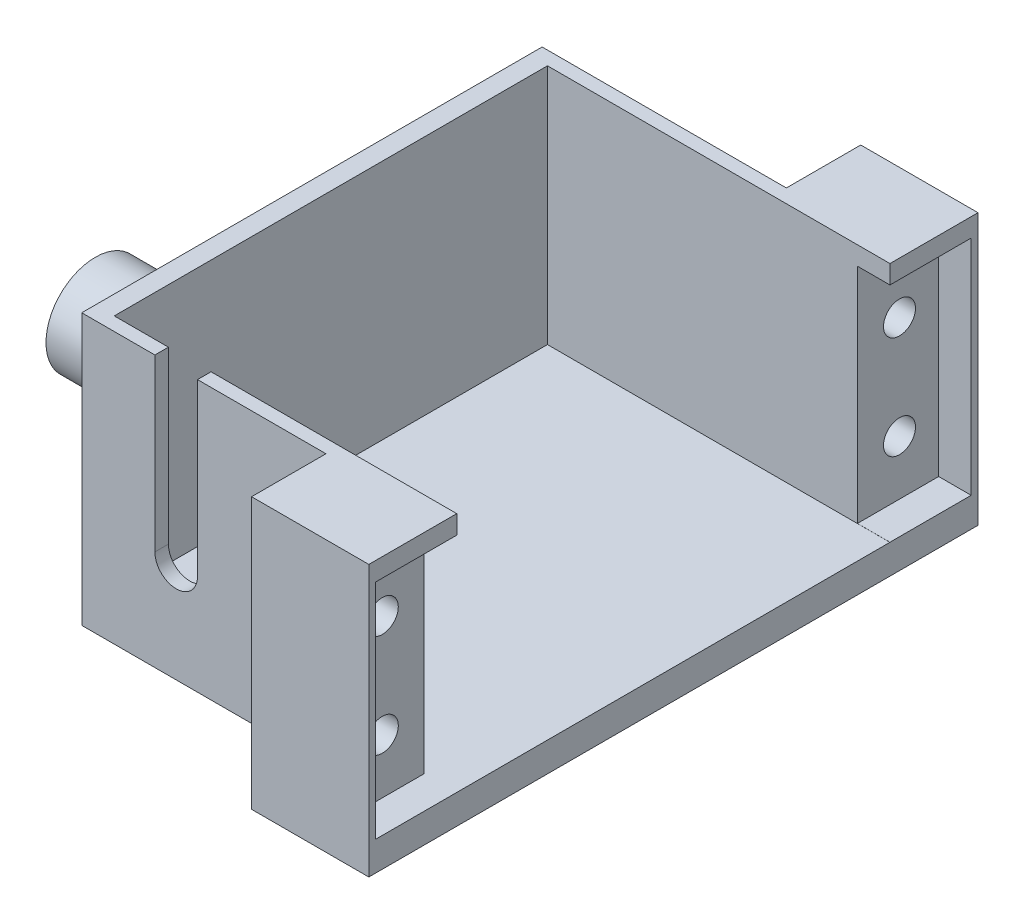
SolidWorks part; units mm, degrees
ref_plane "Front Plane" through (0, 0, 0) normal (0, 0, 1) x (1, 0, 0)
ref_plane "Top Plane" through (0, 0, 0) normal (0, 1, 0) x (1, 0, 0)
ref_plane "Right Plane" through (0, 0, 0) normal (1, 0, 0) x (0, 0, -1)
sketch "Sketch1" plane through (0, 0, 0) normal (0, 1, 0) x (1, 0, 0)
  line L1 (-16.955, -28.575) -> (16.955, -28.575)
  line L2 (-16.955, -28.575) -> (-16.955, 28.575)
  line L3 (-16.955, 28.575) -> (16.955, 28.575)
  line L4 (16.955, -28.575) -> (16.955, 28.575)
  line L5 (-16.955, -28.575) -> (16.955, 28.575) construction
  line L6 (-16.955, 28.575) -> (16.955, -28.575) construction
  point P0 (0, 0)
  dimension "D1" = 57.15
  dimension "D2" = 33.91
extrude "Boss-Extrude1" add sketch "Sketch1" along normal blind 25.4
sketch "Sketch2" plane through (16.955, 0, 0) normal (1, 0, 0) x (0, 0, -1)
  line L0 (0, 0) -> (0, 25.4) construction
  line L1 (-28.575, 25.4) -> (28.575, 25.4) construction
  line L2 (-28.575, 12.7) -> (28.575, 12.7) construction
  line L3 (-28.575, 25.4) -> (-28.575, 0) construction
  line L4 (28.575, 25.4) -> (28.575, 0) construction
  line L5 (-24.26, 17.525) -> (-24.26, 7.875) construction
  circle A0 centre (-24.26, 17.525) radius 1.5
  circle A1 centre (-24.26, 7.875) radius 1.5
  circle A2 centre (24.26, 7.875) radius 1.5
  circle A3 centre (24.26, 17.525) radius 1.5
  point P15 (-24.26, 12.7)
  dimension "D1" = 3
  dimension "D2" = 9.65
  dimension "D3" = 24.26
extrude "Cut-Extrude1" cut sketch "Sketch2" against normal up to next
sketch "Sketch3" plane through (16.955, 0, 0) normal (1, 0, 0) x (0, 0, -1)
  line L0 (-28.575, 25.4) -> (28.575, 25.4) construction
  line L1 (-20.325, 25.4) -> (20.315, 25.4)
  line L2 (-20.325, 25.4) -> (-20.325, 2.75)
  line L3 (-20.325, 2.75) -> (20.315, 2.75)
  line L4 (20.315, 25.4) -> (20.315, 2.75)
  line L5 (-28.575, 0) -> (28.575, 0) construction
  line L6 (28.575, 25.4) -> (28.575, 0) construction
  dimension "D1" = 2.75
  dimension "D2" = 40.64
  dimension "D3" = 8.26
extrude "Cut-Extrude2" cut sketch "Sketch3" against normal blind 32.13
sketch "Sketch4" plane through (16.955, 0, 0) normal (1, 0, 0) x (0, 0, -1)
  line L1 (-20.315, 23.65) -> (-27.935, 23.65)
  line L2 (-20.315, 23.65) -> (-20.315, 2.75)
  line L3 (-20.315, 2.75) -> (-27.935, 2.75)
  line L4 (-27.935, 23.65) -> (-27.935, 2.75)
  line L5 (-28.575, 25.4) -> (-28.575, 0) construction
  line L6 (-20.325, 2.75) -> (20.315, 2.75) construction
  line L7 (-28.575, 25.4) -> (-20.325, 25.4) construction
  line L8 (0, 0) -> (-0.005, 25.4) construction
  line L9 (-28.575, 0) -> (28.575, 0) construction
  line L10 (20.315, 25.4) -> (-20.325, 25.4) construction
  line L11 (-28.575, 12.7) -> (28.575, 12.7) construction
  line L12 (28.575, 25.4) -> (28.575, 0) construction
  line L13 (20.3139, 2.758) -> (27.9339, 2.761)
  line L14 (27.9257, 23.661) -> (27.9339, 2.761)
  line L15 (20.3057, 23.658) -> (27.9257, 23.661)
  line L16 (20.3057, 23.658) -> (20.3139, 2.758)
  dimension "D1" = 0.64
  dimension "D2" = 1.75
  dimension "D3" = 7.62
extrude "Cut-Extrude3" cut sketch "Sketch4" against normal blind 3.05
sketch "Sketch6" plane through (0, 25.4, 0) normal (0, 1, 0) x (1, 0, 0)
  line L0 (16.955, -28.575) -> (16.955, -20.325) construction
  line L1 (-16.955, -28.575) -> (5.955, -28.575)
  line L2 (-16.955, -28.575) -> (-16.955, -21.595)
  line L3 (-16.955, -21.595) -> (5.955, -21.595)
  line L4 (5.955, -28.575) -> (5.955, -21.595)
  line L5 (-15.175, -20.325) -> (16.955, -20.325) construction
  line L6 (-16.955, 0) -> (16.955, 0) construction
  line L7 (-16.955, 28.575) -> (-16.955, -28.575) construction
  line L8 (16.955, -27.935) -> (16.955, 20.315) construction
  line L9 (-16.955, 21.595) -> (5.955, 21.595)
  line L10 (5.955, 28.575) -> (5.955, 21.595)
  line L11 (-16.955, 28.575) -> (5.955, 28.575)
  line L12 (-16.955, 28.575) -> (-16.955, 21.595)
  dimension "D1" = 11
  dimension "D2" = 1.27
extrude "Cut-Extrude6" cut sketch "Sketch6" against normal up to next
sketch "Sketch7" plane through (16.955, 0, 0) normal (1, 0, 0) x (0, 0, -1)
  line L0 (-20.325, 23.65) -> (-20.325, 2.75) construction
  line L1 (-20.325, 23.65) -> (-27.935, 23.65) construction
  circle A0 centre (-10.325, 14.65) radius 3 construction
  dimension "D1" = 6
  dimension "D2" = 10
  dimension "D3" = 9
sketch "Sketch8" plane through (-16.955, 0, 0) normal (-1, 0, 0) x (0, 0, 1)
  circle A0 centre (10.325, 14.65) radius 4.625
  dimension "D1" = 9.25
extrude "Boss-Extrude2" add sketch "Sketch8" along normal blind 10
sketch "Sketch9" plane through (0, 0, 21.595) normal (0, 0, 1) x (1, 0, 0)
  line L0 (-10.095, 25.4) -> (-10.095, 9.4)
  line L1 (5.955, 25.4) -> (-16.955, 25.4) construction
  line L2 (-6.095, 9.4) -> (-6.095, 25.4)
  line L3 (-6.095, 25.4) -> (-10.095, 25.4)
  line L4 (5.955, 0) -> (-16.955, 0) construction
  line L5 (13.905, 23.65) -> (13.905, 2.75) construction
  arc A0 (-10.095, 9.4) -> (-6.095, 9.4) centre (-8.095, 9.4) ccw
  dimension "D1" = 4
  dimension "D2" = 9.4
  dimension "D3" = 20
extrude "Cut-Extrude7" cut sketch "Sketch9" against normal up to next
sketch "Sketch10" plane through (0, 0, 0) normal (0, -1, 0) x (1, 0, 0)
  line L0 (0, 21.595) -> (0, -21.595) construction
  line L1 (5.955, 21.595) -> (-16.955, 21.595) construction
  line L2 (-16.955, -21.595) -> (5.955, -21.595) construction
  line L3 (-16.955, 0) -> (16.955, 0) construction
  line L4 (16.955, 28.575) -> (16.955, -28.575) construction
  line L6 (-4, -4) -> (4, -4)
  line L7 (-4, -4) -> (-4, 4)
  line L8 (-4, 4) -> (4, 4)
  line L9 (4, -4) -> (4, 4)
  line L10 (-4, -4) -> (4, 4) construction
  line L11 (-4, 4) -> (4, -4) construction
  point P7 (0, 0)
  point P12 (0, 0)
  dimension "D1" = 8
  dimension "D2" = 8
extrude "Boss-Extrude3" add sketch "Sketch10" along normal blind 10
sketch "Sketch11" plane through (5.955, 0, 0) normal (-1, 0, 0) x (0, 0, 1)
  line L0 (-28.575, 12.7) -> (28.575, 12.7) construction
  line L1 (-27.01, 15.9373) -> (-24.26, 14.3496)
  line L2 (-24.26, 14.3496) -> (-21.51, 15.9373)
  line L3 (-21.51, 15.9373) -> (-21.51, 19.1127)
  line L4 (-21.51, 19.1127) -> (-24.26, 20.7004)
  line L5 (-24.26, 20.7004) -> (-27.01, 19.1127)
  line L6 (-27.01, 19.1127) -> (-27.01, 15.9373)
  line L7 (-28.575, 0) -> (-28.575, 25.4) construction
  line L8 (28.575, 0) -> (28.575, 25.4) construction
  line L9 (0, 25.4) -> (0, 0) construction
  line L10 (-21.595, 25.4) -> (21.595, 25.4) construction
  line L11 (-27.01, 6.2873) -> (-27.01, 9.4627)
  line L12 (-24.26, 4.6996) -> (-27.01, 6.2873)
  line L13 (-21.51, 6.2873) -> (-24.26, 4.6996)
  line L14 (-21.51, 9.4627) -> (-21.51, 6.2873)
  line L15 (-24.26, 11.0504) -> (-21.51, 9.4627)
  line L16 (-27.01, 9.4627) -> (-24.26, 11.0504)
  line L17 (24.26, 4.6996) -> (27.01, 6.2873)
  line L18 (21.51, 6.2873) -> (24.26, 4.6996)
  line L19 (21.51, 9.4627) -> (21.51, 6.2873)
  line L20 (24.26, 11.0504) -> (21.51, 9.4627)
  line L21 (27.01, 9.4627) -> (24.26, 11.0504)
  line L22 (27.01, 6.2873) -> (27.01, 9.4627)
  line L23 (27.01, 19.1127) -> (27.01, 15.9373)
  line L24 (24.26, 20.7004) -> (27.01, 19.1127)
  line L25 (21.51, 19.1127) -> (24.26, 20.7004)
  line L26 (21.51, 15.9373) -> (21.51, 19.1127)
  line L27 (24.26, 14.3496) -> (21.51, 15.9373)
  line L28 (27.01, 15.9373) -> (24.26, 14.3496)
  circle A0 centre (-24.26, 17.525) radius 2.75 construction
  dimension "D1" = 5.5
extrude "Cut-Extrude8" cut sketch "Sketch11" against normal blind 2.3
